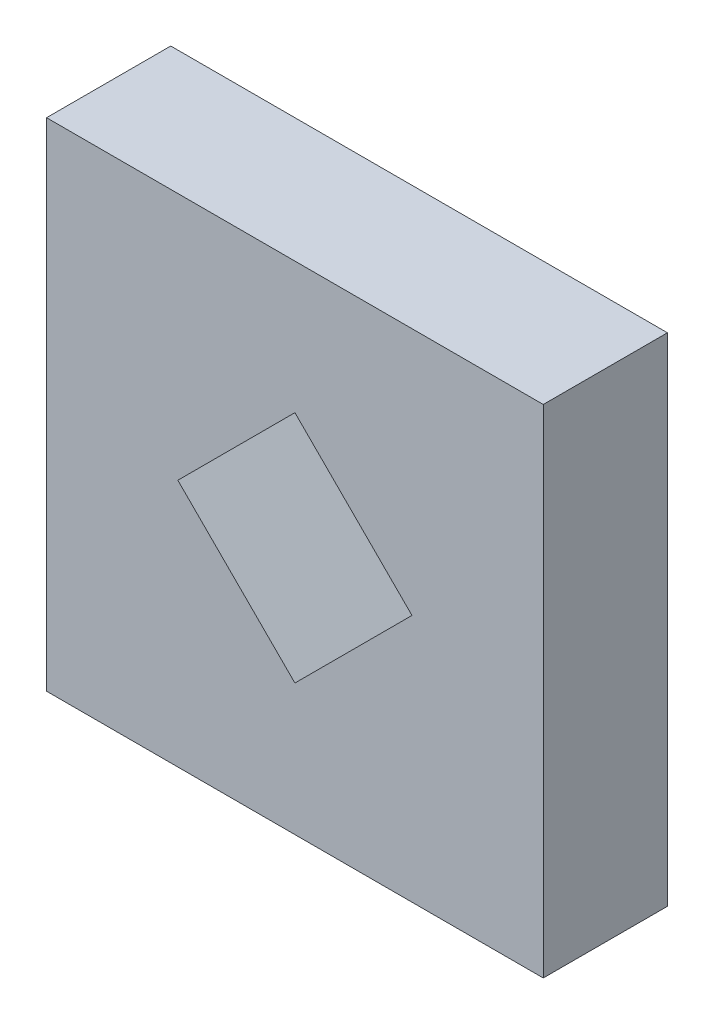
SolidWorks part; units mm, degrees
ref_plane "Front Plane" through (0, 0, 0) normal (0, 0, 1) x (1, 0, 0)
ref_plane "Top Plane" through (0, 0, 0) normal (0, 1, 0) x (1, 0, 0)
ref_plane "Right Plane" through (0, 0, 0) normal (1, 0, 0) x (0, 0, -1)
sketch "Sketch1" plane through (0, 0, 0) normal (0, 0, 1) x (1, 0, 0)
  line L0 (0, 0) -> (-50000, 0) construction
  line L1 (-38.1, 38.1) -> (38.1, 38.1)
  line L2 (-38.1, 38.1) -> (-38.1, -38.1)
  line L3 (-38.1, -38.1) -> (38.1, -38.1)
  line L4 (38.1, 38.1) -> (38.1, -38.1)
  dimension "D1" = 38.1
  dimension "D2" = 76.2
  dimension "D3" = 38.1
  dimension "D4" = 76.2
extrude "Boss-Extrude1" add sketch "Sketch1" along normal mid plane 19.05
sketch "Sketch3" plane through (0, 0, 9.525) normal (0, 0, 1) x (1, 0, 0)
  line L0 (-17.9605, 0) -> (0, 17.9605)
  line L1 (0, 17.9605) -> (17.9605, 0)
  line L2 (17.9605, 0) -> (0, -17.9605)
  line L3 (0, -17.9605) -> (-17.9605, 0)
  line L4 (-38.1, -38.1) -> (38.1, -38.1) construction
  dimension "D1" = 25.4
  dimension "D2" = 25.4
  dimension "D3" = 12.7
  dimension "D4" = 12.7
  dimension "D5" = 45
extrude "Cut-Extrude1" cut sketch "Sketch3" against normal blind 19.05
